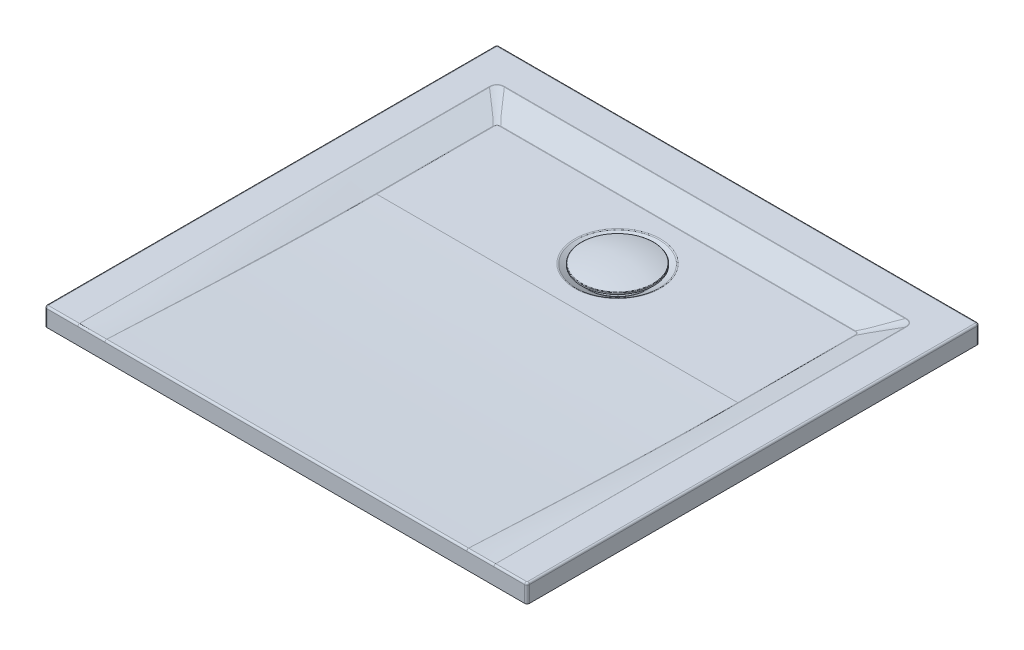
SolidWorks part; units mm, degrees
ref_plane "Płaszczyzna przednia" through (0, 0, 0) normal (0, 0, 1) x (1, 0, 0)
ref_plane "Płaszczyzna górna" through (0, 0, 0) normal (0, 1, 0) x (1, 0, 0)
ref_plane "Płaszczyzna prawa" through (0, 0, 0) normal (1, 0, 0) x (0, 0, -1)
sketch "Szkic1" plane through (0, 0, 0) normal (0, 1, 0) x (1, 0, 0)
  line L0 (0, 375) -> (0, -375) construction
  line L1 (-400, 375) -> (400, 375)
  line L2 (-400, 375) -> (-400, -375)
  line L3 (-400, -375) -> (400, -375)
  line L4 (400, 375) -> (400, -375)
  line L5 (-345, -375) -> (-345, 320)
  line L6 (-345, 320) -> (345, 320)
  line L7 (345, 320) -> (345, -375)
  line L8 (-300, -375) -> (-300, 275)
  line L9 (-300, 275) -> (300, 275)
  line L10 (300, 275) -> (300, -375)
  circle A0 centre (0, 175) radius 45
  circle A1 centre (0, 175) radius 70
  point P9 (0, 320)
  dimension "D6" = 90
  dimension "D7" = 140
  dimension "D1" = 800
  dimension "D2" = 55
  dimension "D3" = 55
  dimension "D5" = 200
  dimension "D8" = 750
  dimension "D4" = 45
sketch "Szkic2" plane through (0, 0, 0) normal (0, 1, 0) x (1, 0, 0)
  line L0 (-400, -375) -> (400, -375) construction
  line L1 (400, 375) -> (400, -375) construction
  line L2 (345, 320) -> (345, -375) construction
  line L3 (-345, 320) -> (345, 320) construction
  line L4 (-400, 375) -> (400, 375) construction
  line L5 (-345, -375) -> (-345, 320) construction
  line L6 (-400, 375) -> (-400, -375) construction
  line L7 (-400, -375) -> (-345, -375)
  line L8 (400, 375) -> (400, -375)
  line L9 (345, 320) -> (345, -375)
  line L10 (-345, 320) -> (345, 320)
  line L11 (-400, 375) -> (400, 375)
  line L12 (-345, -375) -> (-345, 320)
  line L13 (-400, 375) -> (-400, -375)
  line L14 (345, -375) -> (400, -375)
surface "Powierzchnia-Płaszczyzna1" sketch "Szkic2"
ref_plane "Płaszczyzna1" through (0, -15, 0) normal (0, 1, 0) x (-1, 0, 0)
sketch "Szkic3" plane through (0, -15, 0) normal (0, 1, 0) x (-1, 0, 0)
  line L0 (300, -75) -> (-300, -75)
  line L1 (300, 375) -> (300, -275) construction
  line L2 (-300, -275) -> (-300, 375) construction
  line L3 (0, -75) -> (0, -275) construction
  line L4 (300, -275) -> (-300, -275) construction
  line L5 (-300, -275) -> (-300, -75)
  line L6 (300, -75) -> (300, -275)
  line L7 (300, -275) -> (-300, -275)
  circle A0 centre (0, -175) radius 70 construction
  circle A1 centre (0, -175) radius 70
  point P10 (0, -175)
surface "Powierzchnia-Płaszczyzna2" sketch "Szkic3"
sketch "Szkic4" plane through (0, 0, 0) normal (0, 1, 0) x (1, 0, 0)
  line L0 (300, -375) -> (-300, -375)
other "Granica-Powierzchnia1"
other "Granica-Powierzchnia2"
other "Granica-Powierzchnia3"
mirror "Lustro1" about plane through (0, 0, 0) normal (1, 0, 0)
sketch "Szkic5" plane through (0, 0, 0) normal (0, 1, 0) x (1, 0, 0)
  line L0 (400, 375) -> (400, -375) construction
  line L1 (-400, 375) -> (400, 375) construction
  line L2 (-400, 375) -> (-400, -375) construction
  line L3 (-400, -375) -> (400, -375) construction
  line L4 (400, 375) -> (400, -375)
  line L5 (-400, 375) -> (400, 375)
  line L6 (-400, 375) -> (-400, -375)
  line L7 (-400, -375) -> (400, -375)
surface "Powierzchnia-Wyciągnięcie1" sketch "Szkic5" parameters "D1"=30
sketch "Szkic7" plane through (0, 0, 0) normal (1, 0, 0) x (0, 0, -1)
  line L0 (175, 0) -> (175, -30) construction
  line L1 (375, -30) -> (-375, -30) construction
  line L2 (220, -30) -> (220, -28)
  line L3 (220, -28) -> (224, -28)
  line L6 (224, -28) -> (245, -15)
  dimension "D1" = 90
  dimension "D2" = 2
  dimension "D3" = 98
surface "Powierzchnia-Obrót wokół linii środkowej1" sketch "Szkic7" parameters "D1"=360
surface "Powierzchnia-Płaszczyzna3"
surface "Powierzchnia-Połącz1"
fillet "Zaokrąglenie1" radius 4 6 edges at (0, -28, -224) (0, -15, -105) (400, -15, 375) (400, -15, -375) (-400, -15, -375) (-400, -15, 375)
fillet "Zmienne zaokrąglenie1" radius 40 2 edges at (322.5, -7.5, -297.5)
fillet "Zaokrąglenie3" radius 3 12 edges
fillet "Zaokrąglenie4" radius 3 12 edges at (-398.8284, 0, -373.8284) (0, 0, -375) (398.8284, 0, -373.8284) (400, 0, 0) (398.8284, 0, 373.8284) (370.5, 0, 375) (-370.5, 0, 375) (-398.8284, 0, 373.8284) (-400, 0, 0)
sketch "Szkic8" plane through (0, 0, 0) normal (1, 0, 0) x (0, 0, -1)
  line L0 (175, 0) -> (175, -30) construction
  line L1 (175, -5.6601) -> (179.8469, -5.6601) construction
  line L2 (235, -14.7573) -> (235, -17)
  line L3 (235, -17) -> (175, -17)
  line L4 (175, -17) -> (175, -5.6601)
  line L5 (175, -5.6601) -> (199.9922, 95.6514)
  arc A0 (175, -5.6601) -> (234.2694, -13.7943) centre (175, -225.6601) cw
  arc A1 (234.2694, -13.7943) -> (235, -14.7573) centre (234, -14.7573) cw
  point P11 (235, -14)
  dimension "D1" = 220
  dimension "D4" = 1
  dimension "D2" = 60
  dimension "D3" = 3
  dimension "D5" = 13
revolve "Obrót wokół linii środkowej1" add sketch "Szkic8" angle 360 about L4
